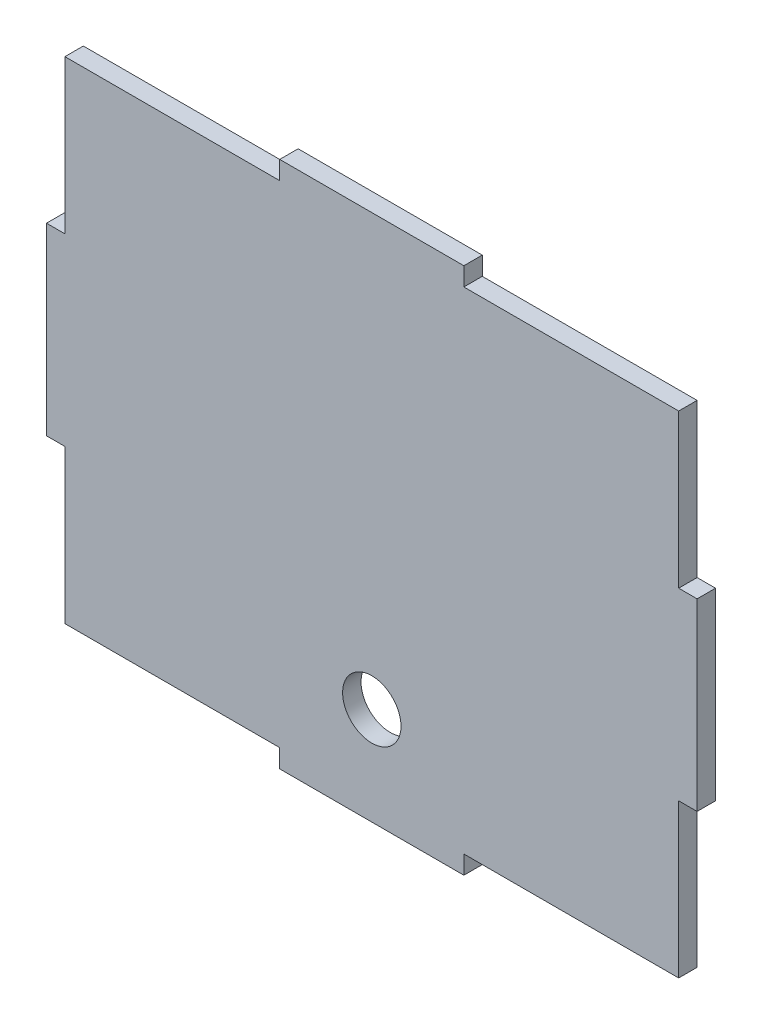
SolidWorks part; units mm, degrees
ref_plane "Alzado" through (0, 0, 0) normal (0, 0, 1) x (1, 0, 0)
ref_plane "Planta" through (0, 0, 0) normal (0, 1, 0) x (1, 0, 0)
ref_plane "Vista lateral" through (0, 0, 0) normal (1, 0, 0) x (0, 0, -1)
sketch "Croquis1" plane through (0, 0, 0) normal (0, 0, 1) x (1, 0, 0)
  line L0 (15, 40) -> (50, 40)
  line L1 (-50, -40) -> (-15, -40)
  line L2 (-50, -40) -> (-50, -15)
  line L3 (-50, 40) -> (-15, 40)
  line L4 (50, -40) -> (50, -15)
  line L5 (-50, -40) -> (50, 40) construction
  line L6 (-50, 40) -> (50, -40) construction
  line L7 (-50, 15) -> (-50, 40)
  line L8 (-15, 40) -> (-15, 43)
  line L9 (-15, 43) -> (15, 43)
  line L10 (15, 40) -> (15, 43)
  line L11 (-50, 15) -> (-53, 15)
  line L12 (0, 0) -> (0, 43) construction
  line L13 (-50, -15) -> (-53, -15)
  line L14 (-53, 15) -> (-53, -15)
  line L15 (0, 0) -> (-53, 0) construction
  line L16 (50, -15) -> (53, -15)
  line L17 (53, 15) -> (53, -15)
  line L18 (50, 15) -> (53, 15)
  line L19 (15, -40) -> (15, -43)
  line L20 (-15, -43) -> (15, -43)
  line L21 (-15, -40) -> (-15, -43)
  line L22 (50, 15) -> (50, 40)
  line L23 (15, -40) -> (50, -40)
  circle A0 centre (0, -27.1037) radius 4.755
  point P0 (0, 0)
  point P14 (0, 43)
  point P16 (-53, 0)
  point P29 (0, 0)
  dimension "D7" = 9.51
  dimension "D1" = 80
  dimension "D2" = 100
  dimension "D3" = 3
  dimension "D4" = 30
  dimension "D5" = 3
  dimension "D6" = 30
extrude "Saliente-Extruir1" add sketch "Croquis1" along normal blind 3
